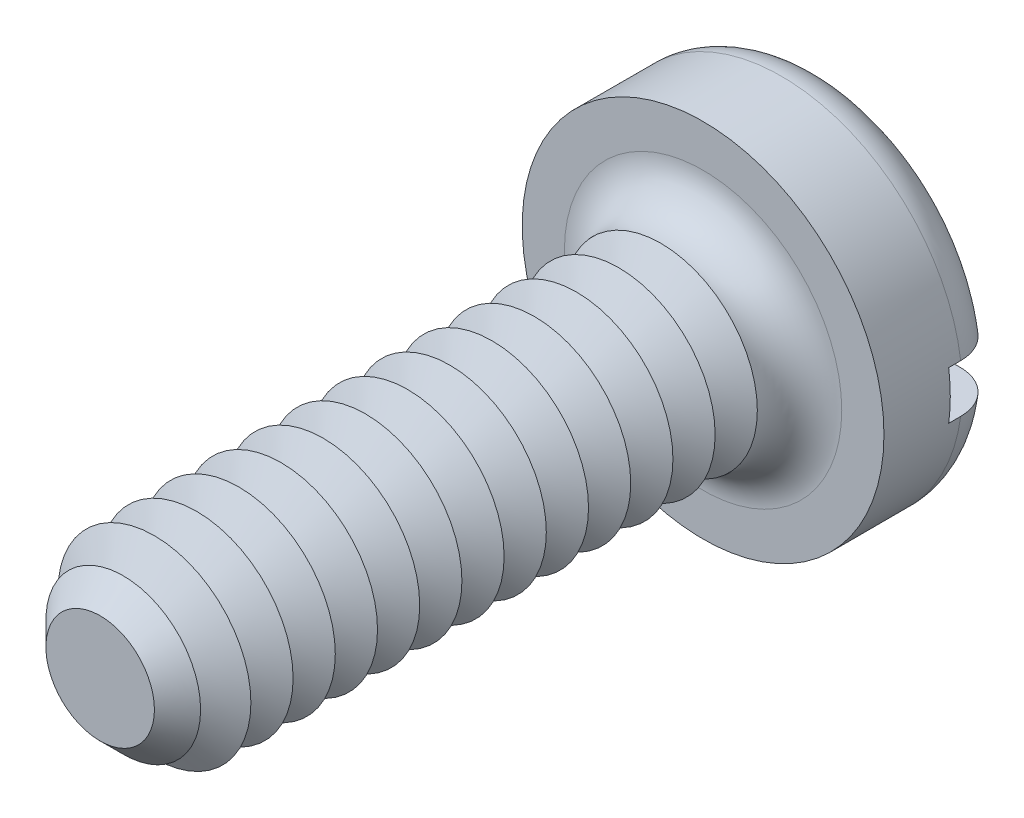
SolidWorks part; units mm, degrees
ref_plane "Front Plane" through (0, 0, 0) normal (0, 0, 1) x (1, 0, 0)
ref_plane "Top Plane" through (0, 0, 0) normal (0, 1, 0) x (1, 0, 0)
ref_plane "Right Plane" through (0, 0, 0) normal (1, 0, 0) x (0, 0, -1)
sketch "Sketch3" plane through (0, 0, 0) normal (0, 0, 1) x (1, 0, 0)
  circle A0 centre (0, 0) radius 1.5
  dimension "D1" = 3
extrude "Boss-Extrude2" add sketch "Sketch3" against normal blind 1
sketch "Sketch4" plane through (0, 0, 0) normal (0, 0, 1) x (1, 0, 0)
  circle A0 centre (0, 0) radius 0.8
  dimension "D1" = 1.6
extrude "Boss-Extrude3" add sketch "Sketch4" along normal blind 5
fillet "Fillet1" radius 0.35 2 edges at (1.5, 0, -1) (0.8, 0, 0)
chamfer "Chamfer1" distance 0.35 angle 45 1 edges at (0.8, 0, 5)
sketch "Sketch5" plane through (0, 0, 0) normal (1, 0, 0) x (0, 0, -1)
  line L0 (1.6944, 0) -> (-7.6738, 0) construction
sketch "Sketch6" plane through (0, 0, 0) normal (1, 0, 0) x (0, 0, -1)
  line L0 (-0.35, 0.8) -> (-0.525, 0.4969)
  line L1 (-0.525, 0.4969) -> (-0.7, 0.8)
  line L2 (-0.35, 0.8) -> (-4.65, 0.8) construction
  line L3 (-0.7, 0.8) -> (-0.35, 0.8)
  dimension "D1" = 0.35
revolve "Cut-Revolve1" cut sketch "Sketch6" angle 360 about L0
pattern_linear "LPattern1" count 13 spacing 0.35 along (0, 0, 1) of "Cut-Revolve1"
sketch "Sketch8" plane through (0, 0, -1) normal (0, 0, -1) x (-1, 0, 0)
  line L1 (1.5, -0.2) -> (-1.5, -0.2)
  line L2 (1.5, -0.2) -> (1.5, 0.2)
  line L3 (1.5, 0.2) -> (-1.5, 0.2)
  line L4 (-1.5, -0.2) -> (-1.5, 0.2)
  line L5 (1.5, -0.2) -> (-1.5, 0.2) construction
  line L6 (1.5, 0.2) -> (-1.5, -0.2) construction
  point P0 (0, 0)
  dimension "D1" = 3
  dimension "D2" = 0.4
extrude "Cut-Extrude1" cut sketch "Sketch8" against normal blind 0.45
